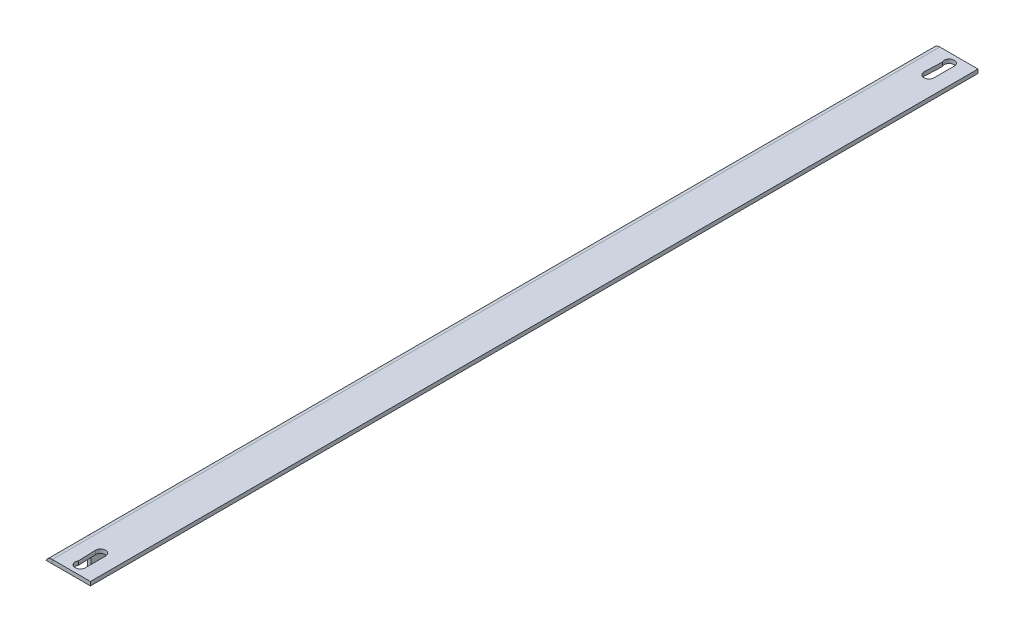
SolidWorks part; units mm, degrees
ref_plane "Plan de face" through (0, 0, 0) normal (0, 0, 1) x (1, 0, 0)
ref_plane "Plan de dessus" through (0, 0, 0) normal (0, 1, 0) x (1, 0, 0)
ref_plane "Plan de droite" through (0, 0, 0) normal (1, 0, 0) x (0, 0, -1)
sketch "Esquisse1" plane through (0, 0, 0) normal (0, 0, 1) x (1, 0, 0)
  line L0 (31.9465, 52.6637) -> (-26.0535, 52.6637)
  line L1 (-26.0535, 52.6637) -> (-26.0535, -5.3363)
  line L2 (-26.0535, -5.3363) -> (-21.0535, -5.3363)
  line L3 (-21.0535, -5.3363) -> (-21.0535, 47.6637)
  line L4 (-21.0535, 47.6637) -> (31.9465, 47.6637)
  line L5 (31.9465, 47.6637) -> (31.9465, 52.6637)
  dimension "D1" = 58
  dimension "D2" = 58
  dimension "D3" = 5
  dimension "D4" = 5
extrude "Extrusion1" add sketch "Esquisse1" along normal mid plane 1140
sheet metal parameters "Tôlerie 1" parameters "D1"=4, "Epaisseur"=5
bend "Pli dans angle1" bend angle 90 parameters "D1"=0, "D5"=1
flatten bends "Dépliage 1" parameters "D1"=0
sketch "Esquisse-Angle1" plane through (-21.0535, 0, 0) normal (1, 0, 0) x (0, 0, -1)
  line L0 (570, 50.7323) -> (-570, 50.7323) construction
process bends "Pliage 1" parameters "D1"=0
sketch "Esquisse-Plate1" plane through (-21.0535, 0, 0) normal (1, 0, 0) x (0, 0, -1)
sketch "Esquisse4" plane through (-21.0535, 0, 0) normal (1, 0, 0) x (0, 0, -1)
  line L1 (-1118.4815, 47.6637) -> (-516, 47.6637)
  line L2 (-1118.4815, 47.6637) -> (-1118.4815, -20.6326)
  line L3 (-1118.4815, -20.6326) -> (-516, -20.6326)
  line L4 (-516, 47.6637) -> (-516, -20.6326)
  line L5 (-570, -5.3363) -> (-570, 43.6637) construction
  line L6 (-570, 47.6637) -> (570, 47.6637) construction
  line L8 (570, 47.6637) -> (516, 47.6637)
  line L9 (570, 47.6637) -> (570, -14.2724)
  line L10 (570, -14.2724) -> (516, -14.2724)
  line L11 (516, 47.6637) -> (516, -14.2724)
  dimension "D1" = 54
  dimension "D2" = 54
extrude "Enlèv. mat.-Extru.1" cut sketch "Esquisse4" against normal mid plane 140
sketch "Esquisse5" plane through (-21.0535, 0, 0) normal (1, 0, 0) x (0, 0, -1)
  line L0 (-516, 43.6637) -> (-516, -5.3363) construction
  line L1 (-516, -5.3363) -> (516, -5.3363) construction
  circle A0 centre (-450, 19.6637) radius 6.5
  circle A1 centre (-350, 19.6637) radius 6.5
  circle A2 centre (-250, 19.6637) radius 6.5
  circle A3 centre (-150, 19.6637) radius 6.5
  circle A4 centre (-50, 19.6637) radius 6.5
  circle A5 centre (50, 19.6637) radius 6.5
  circle A6 centre (150, 19.6637) radius 6.5
  circle A7 centre (250, 19.6637) radius 6.5
  circle A8 centre (350, 19.6637) radius 6.5
  circle A9 centre (450, 19.6637) radius 6.5
  dimension "D1" = 13
  dimension "D2" = 66
  dimension "D3" = 25
extrude "Enlèv. mat.-Extru.2" cut sketch "Esquisse5" against normal through all
sketch "Esquisse6" plane through (0, 52.6637, 0) normal (0, 1, 0) x (-1, 0, 0)
  line L0 (-1.3173, 554.75) -> (-0.4513, 532.25)
  line L1 (-13.4465, 558) -> (-13.4465, 532)
  line L2 (-31.9465, 570) -> (17.0535, 570) construction
  line L3 (-31.9465, 570) -> (-31.9465, -570) construction
  arc A0 (-1.3173, 554.75) -> (-13.4465, 558) centre (-6.9465, 558) ccw
  arc A1 (-13.4465, 532) -> (-0.4513, 532.25) centre (-6.9465, 532) ccw
  dimension "D1" = 13
  dimension "D2" = 13
  dimension "D3" = 26
  dimension "D4" = 12
  dimension "D5" = 25
extrude "Enlèv. mat.-Extru.3" cut sketch "Esquisse6" against normal through all
mirror "Symétrie1" about plane through (0, 0, 0) normal (0, 0, 1) of "Enlèv. mat.-Extru.3"
